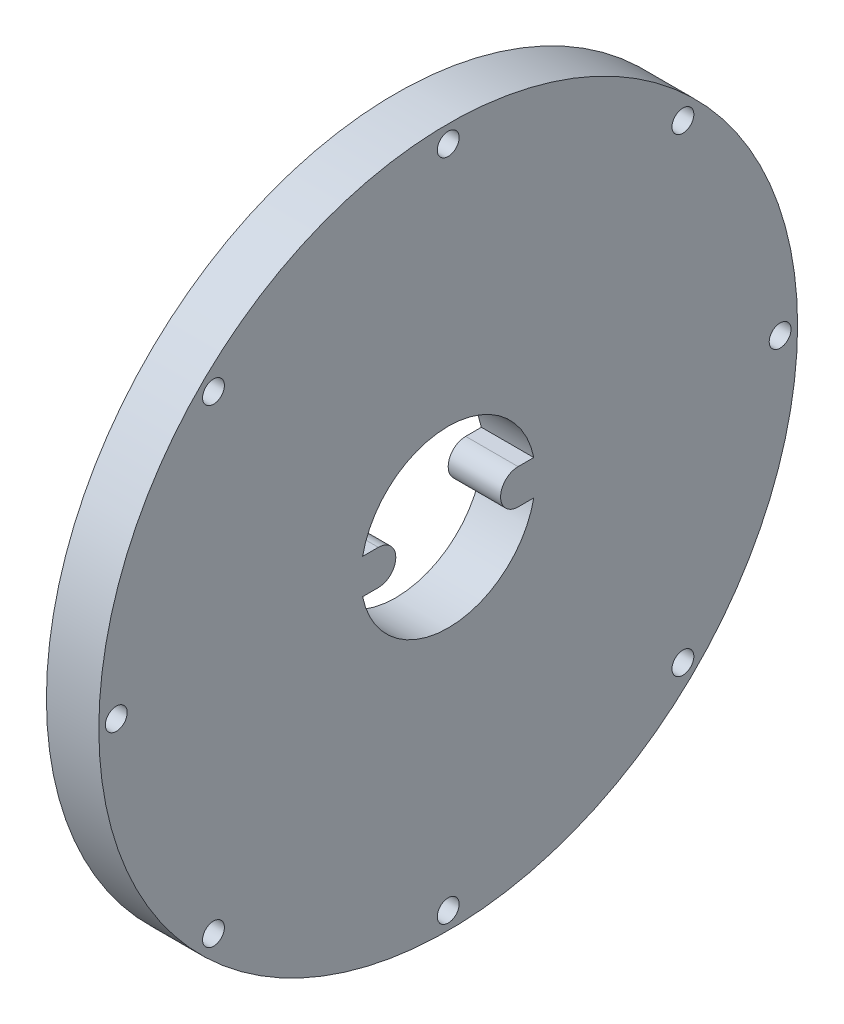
SolidWorks part; units mm, degrees
ref_plane "Plan de face" through (0, 0, 0) normal (0, 0, 1) x (1, 0, 0)
ref_plane "Plan de dessus" through (0, 0, 0) normal (0, 1, 0) x (1, 0, 0)
ref_plane "Plan de droite" through (0, 0, 0) normal (1, 0, 0) x (0, 0, -1)
sketch "Esquisse1" plane through (0, 0, 0) normal (1, 0, 0) x (0, 0, -1)
  line L0 (0, -44.3127) -> (0, 91.8426) construction
  line L1 (-29.1578, 0) -> (31.462, 0) construction
  line L2 (-29.1578, -4) -> (-6.8077, -4) construction
  line L3 (-29.1578, 4) -> (-6.8077, 4) construction
  line L4 (-12, 3.2168) -> (-12, -7.504) construction
  line L5 (-16, 2.2896) -> (-16, -7.504) construction
  line L6 (-16, 4) -> (-19.5959, 4)
  line L7 (-16, -4) -> (-19.5959, -4)
  line L8 (16, 4) -> (19.5959, 4)
  line L9 (16, -4) -> (19.5959, -4)
  circle A0 centre (0, 0) radius 80
  arc A1 (-19.5959, -4) -> (19.5959, -4) centre (0, 0) ccw
  arc A2 (-16, -4) -> (-16, 4) centre (-16, 0) ccw
  arc A3 (16, -4) -> (16, 4) centre (16, 0) cw
  arc A4 (19.5959, 4) -> (-19.5959, 4) centre (0, 0) ccw
  circle A5 centre (0, 0) radius 76 construction
  circle A6 centre (53.7401, 53.7401) radius 1.5
  circle A9 centre (76, 0) radius 1.5
  circle A11 centre (53.7401, -53.7401) radius 1.5
  circle A13 centre (0, -76) radius 1.5
  circle A15 centre (-53.7401, -53.7401) radius 1.5
  circle A17 centre (-76, 0) radius 1.5
  circle A19 centre (-53.7401, 53.7401) radius 1.5
  circle A21 centre (0, 76) radius 1.5
  circle A36 centre (29.0839, 70.2148) radius 1.5
  circle A37 centre (70.2148, 29.0839) radius 1.5
  circle A38 centre (70.2148, -29.0839) radius 1.5
  circle A39 centre (29.0839, -70.2148) radius 1.5
  circle A40 centre (-29.0839, -70.2148) radius 1.5
  circle A41 centre (-70.2148, -29.0839) radius 1.5
  circle A42 centre (-70.2148, 29.0839) radius 1.5
  circle A43 centre (-29.0839, 70.2148) radius 1.5
  dimension "D1" = 4
  dimension "D5" = 16
  dimension "D2" = 8
  dimension "D3" = 4
  dimension "D4" = 12
extrude "Boss.-Extru.1" add sketch "Esquisse1" along normal blind 12
sketch "Esquisse2" plane through (12, 0, 0) normal (1, 0, 0) x (0, 0, -1)
  circle A0 centre (0, 0) radius 76 construction
  circle A1 centre (0, 76) radius 2.5
  circle A3 centre (53.7401, 53.7401) radius 2.5
  circle A5 centre (76, 0) radius 2.5
  circle A7 centre (53.7401, -53.7401) radius 2.5
  circle A9 centre (0, -76) radius 2.5
  circle A11 centre (-53.7401, -53.7401) radius 2.5
  circle A13 centre (-76, 0) radius 2.5
  circle A15 centre (-53.7401, 53.7401) radius 2.5
  circle A31 centre (-29.0839, 70.2148) radius 2.5
  circle A32 centre (29.0839, 70.2148) radius 2.5
  circle A33 centre (70.2148, 29.0839) radius 2.5
  circle A34 centre (70.2148, -29.0839) radius 2.5
  circle A35 centre (29.0839, -70.2148) radius 2.5
  circle A36 centre (-29.0839, -70.2148) radius 2.5
  circle A37 centre (-70.2148, -29.0839) radius 2.5
  circle A38 centre (-70.2148, 29.0839) radius 2.5
  dimension "D1" = 16
extrude "Enlèv. mat.-Extru.1" cut sketch "Esquisse2" against normal blind 5
